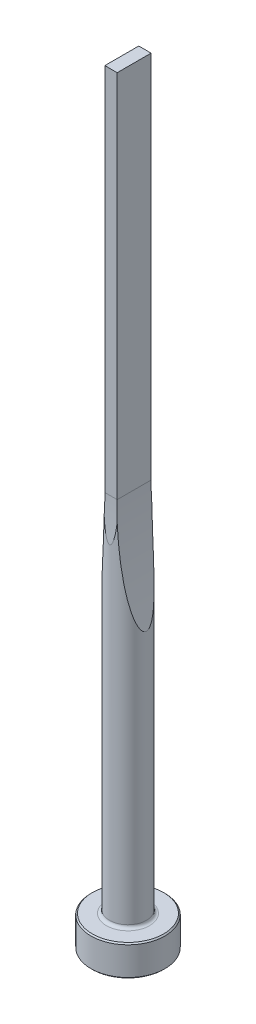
SolidWorks part; units mm, degrees
ref_plane "Front Plane" through (0, 0, 0) normal (0, 0, 1) x (1, 0, 0)
ref_plane "Top Plane" through (0, 0, 0) normal (0, 1, 0) x (1, 0, 0)
ref_plane "Right Plane" through (0, 0, 0) normal (1, 0, 0) x (0, 0, -1)
sketch "Sketch1" plane through (0, 0, 0) normal (0, 0, 1) x (1, 0, 0)
  line L0 (0, 0) -> (5.8, 0)
  line L1 (55, 0) -> (-55, 0) construction
  line L2 (6, 0.2) -> (6, 4.8)
  line L3 (5.8, 5) -> (3.5, 5)
  line L4 (3, 5.5) -> (3, 125)
  line L5 (0, 125) -> (3, 125)
  line L6 (6, 4.8) -> (5.8, 5)
  line L7 (5.8, 0) -> (6, 0.2)
  line L8 (0, 125) -> (0, 0)
  arc A0 (3, 5.5) -> (3.5, 5) centre (3.5, 5.5) ccw
  point P1 (6, 0)
  point P6 (6, 5)
  dimension "D4" = 0.5
  dimension "D1" = 3
  dimension "D2" = 6
  dimension "D3" = 5
  dimension "D5" = 125
revolve "Revolve1" add sketch "Sketch1" angle 360 about L8
sketch "Sketch2" plane through (0, 0, 0) normal (0, 0, 1) x (1, 0, 0)
  line L0 (1, 125) -> (1, 65)
  line L1 (3, 125) -> (-3, 125) construction
  line L2 (-1, 125) -> (-1, 65)
  line L3 (3, 125) -> (3, 46.132)
  line L4 (-3, 125) -> (-3, 46.132)
  line L5 (0, -6.6) -> (0, 6.6) construction
  line L6 (3, 125) -> (1, 125)
  line L8 (-1, 125) -> (-3, 125)
  arc A0 (1, 65) -> (3, 46.132) centre (91, 65) ccw
  arc A1 (-1, 65) -> (-3, 46.132) centre (-91, 65) cw
  dimension "D4" = 90
  dimension "D1" = 60
  dimension "D2" = 2
  dimension "D3" = 1
extrude "Cut-Extrude1" cut sketch "Sketch2" against normal mid plane 10
sketch "Sketch3" plane through (0, 0, 0) normal (1, 0, 0) x (0, 0, -1)
  line L0 (2.75, 125) -> (2.75, 65)
  line L1 (-2.8284, 125) -> (2.8284, 125) construction
  line L2 (-2.75, 125) -> (-2.75, 65)
  line L3 (3, 125) -> (3, 58.2965)
  line L4 (2.75, 125) -> (3, 125)
  line L5 (0, 6.6) -> (0, -6.6) construction
  line L6 (-3, 125) -> (-3, 58.2965)
  line L8 (-2.75, 125) -> (-3, 125)
  arc A0 (2.75, 65) -> (3, 58.2965) centre (92.75, 65) ccw
  arc A1 (-2.75, 65) -> (-3, 58.2965) centre (-92.75, 65) cw
  dimension "D2" = 90
  dimension "D1" = 60
  dimension "D3" = 5.5
  dimension "D4" = 2.75
extrude "Cut-Extrude2" cut sketch "Sketch3" against normal mid plane 10
